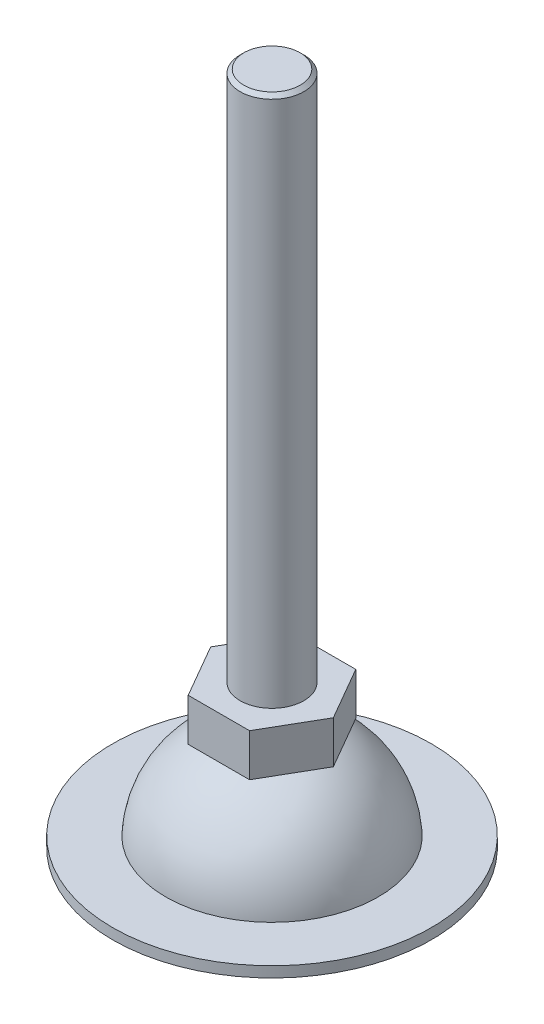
SolidWorks part; units mm, degrees
ref_plane "正面" through (0, 0, 0) normal (0, 0, 1) x (1, 0, 0)
ref_plane "平面" through (0, 0, 0) normal (0, 1, 0) x (1, 0, 0)
ref_plane "右側面" through (0, 0, 0) normal (1, 0, 0) x (0, 0, -1)
sketch "ｽｹｯﾁ1" plane through (0, 0, 0) normal (1, 0, 0) x (0, 0, -1)
  line L1 (0, 127) -> (0, 0)
  line L2 (-30, 0) -> (0, 0)
  line L3 (-30, 2) -> (-20, 2)
  line L4 (-30, 2) -> (-30, 0)
  line L5 (-5.3, 127) -> (0, 127)
  line L6 (-6, 126.3) -> (-5.3, 127)
  line L7 (-6, 19.3689) -> (-6, 126.3)
  arc A0 (-6, 19.3689) -> (-20, 2) centre (-0.8966, 0.9287) ccw
  dimension "D1" = 6
revolve "回転1" add sketch "ｽｹｯﾁ1" angle 360 about L1
ref_plane "平面1" through (0, 19, 0) normal (0, -1, 0) x (1, 0, 0)
sketch "ｽｹｯﾁ2" plane through (0, 19, 0) normal (0, -1, 0) x (1, 0, 0)
  line L0 (-11.547, 0) -> (-5.7735, 10)
  line L1 (11.547, 0) -> (5.7735, 10)
  line L2 (5.7735, -10) -> (-5.7735, -10)
  line L3 (-5.7735, -10) -> (-11.547, 0)
  line L4 (5.7735, -10) -> (11.547, 0)
  line L5 (5.7735, 10) -> (-5.7735, 10)
extrude "押し出し1" add sketch "ｽｹｯﾁ2" against normal blind 8
